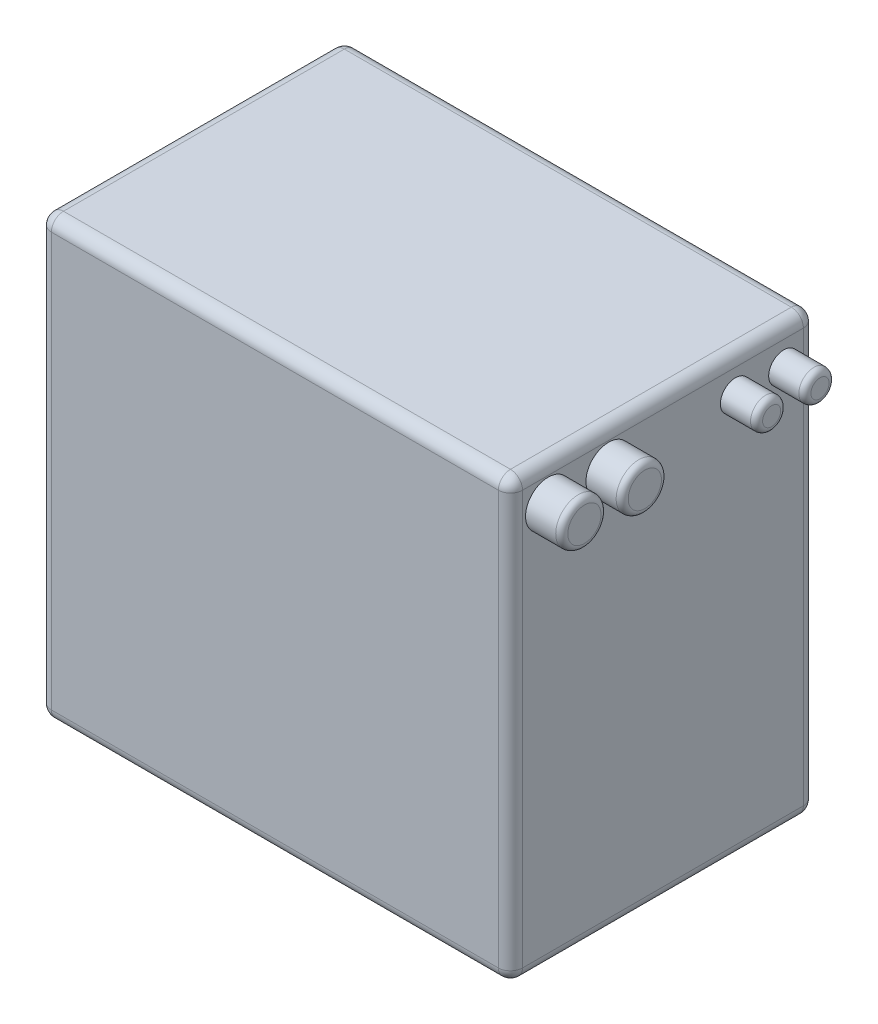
SolidWorks part; units mm, degrees
ref_plane "Front Plane" through (0, 0, 0) normal (0, 0, 1) x (1, 0, 0)
ref_plane "Top Plane" through (0, 0, 0) normal (0, 1, 0) x (1, 0, 0)
ref_plane "Right Plane" through (0, 0, 0) normal (1, 0, 0) x (0, 0, -1)
sketch "Sketch1" plane through (0, 0, 0) normal (0, 0, 1) x (1, 0, 0)
  line L0 (0, 0) -> (247.65, 0)
  line L1 (247.65, 0) -> (247.65, 230.1748)
  line L2 (247.65, 230.1748) -> (0, 230.1748)
  line L3 (0, 230.1748) -> (0, 0)
  dimension "D1" = 230.1748
  dimension "D2" = 247.65
extrude "Boss-Extrude1" add sketch "Sketch1" along normal mid plane 160.3248
fillet "Fillet1" radius 6.35 12 edges at (0, 0, 0) (0, 230.1748, 0) (247.65, 0, 0) (247.65, 230.1748, 0) (123.825, 0, -80.1624) (247.65, 115.0874, -80.1624) (123.825, 230.1748, -80.1624) (0, 115.0874, -80.1624) (123.825, 230.1748, 80.1624) (247.65, 115.0874, 80.1624) (123.825, 0, 80.1624) (0, 115.0874, 80.1624)
sketch "Sketch2" plane through (247.65, 0, 0) normal (1, 0, 0) x (0, 0, -1)
  line L0 (0, 0) -> (0, 102.9066) construction
  line L1 (-73.8124, 230.1748) -> (73.8124, 230.1748) construction
  circle A0 centre (63.5, 211.1248) radius 7.9375
  circle A1 centre (38.1, 211.1248) radius 7.9375
  circle A2 centre (-28.575, 211.1248) radius 11.9126
  circle A3 centre (-60.325, 211.1248) radius 11.9126
  dimension "D6" = 15.875
  dimension "D7" = 23.8252
  dimension "D1" = 25.4
  dimension "D2" = 31.75
  dimension "D3" = 38.1
  dimension "D4" = 28.575
  dimension "D5" = 19.05
extrude "Boss-Extrude2" add sketch "Sketch2" along normal blind 19.05 separate body
fillet "Fillet2" radius 3.175 1 edges at (266.7, 211.1248, 48.4124)
fillet "Fillet3" radius 3.175 1 edges at (266.7, 211.1248, 16.6624)
fillet "Fillet4" radius 3.175 1 edges at (266.7, 211.1248, -46.0375)
fillet "Fillet5" radius 3.175 1 edges at (266.7, 211.1248, -71.4375)
